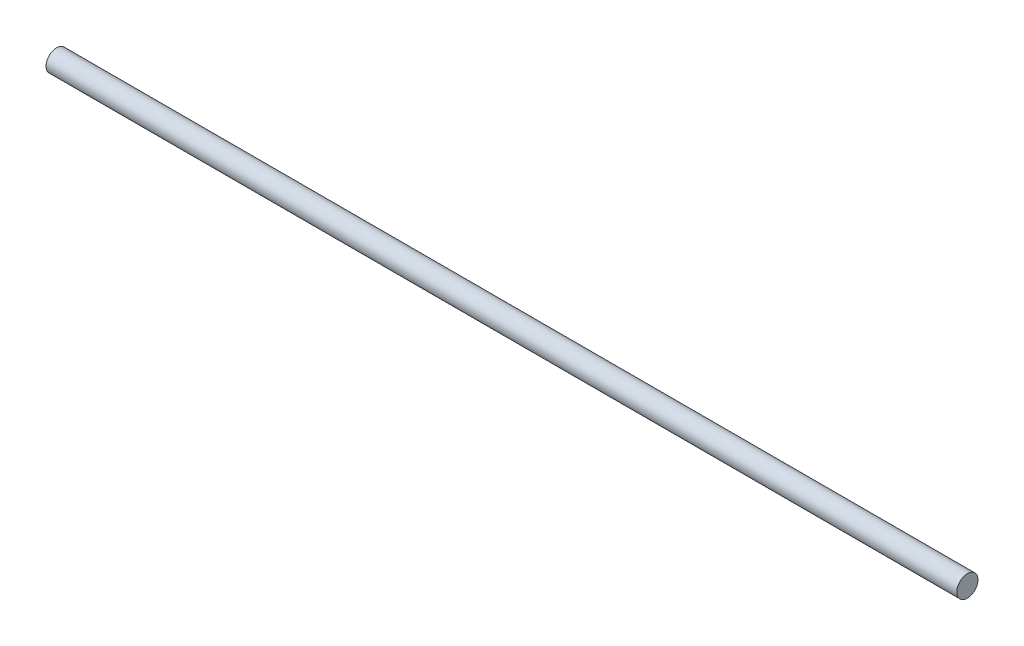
SolidWorks part; units mm, degrees
ref_plane "Front Plane" through (0, 0, 0) normal (0, 0, 1) x (1, 0, 0)
ref_plane "Top Plane" through (0, 0, 0) normal (0, 1, 0) x (1, 0, 0)
ref_plane "Right Plane" through (0, 0, 0) normal (1, 0, 0) x (0, 0, -1)
sketch "Sketch1" plane through (0, 0, 0) normal (1, 0, 0) x (0, 0, -1)
  circle A0 centre (0, 0) radius 7
  dimension "D1" = 14
extrude "Extrude1" add sketch "Sketch1" along normal blind 500 and the other way blind 100
